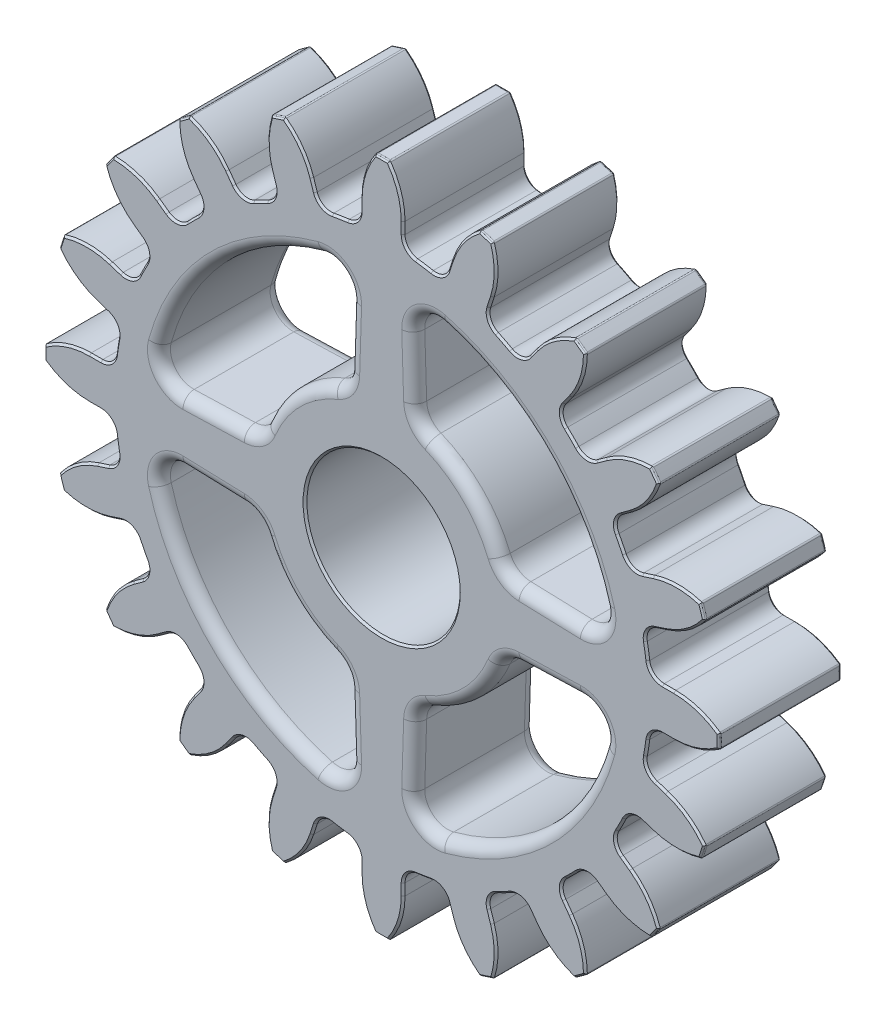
SolidWorks part; units mm, degrees
ref_plane "Спереди" through (0, 0, 0) normal (0, 0, 1) x (1, 0, 0)
ref_plane "Сверху" through (0, 0, 0) normal (0, 1, 0) x (1, 0, 0)
ref_plane "Справа" through (0, 0, 0) normal (1, 0, 0) x (0, 0, -1)
sketch "Эскиз1" plane through (0, 0, 0) normal (0, 0, 1) x (1, 0, 0)
  line L0 (0, 0) -> (0, 44) construction
  line L1 (0, 0) -> (-44, 0) construction
  line L2 (-2.8, 38.1058) -> (-2.8, 36.6039)
  line L3 (2.8, 38.1058) -> (2.8, 36.6039)
  line L4 (9.1124, 37.106) -> (8.6483, 35.6776)
  line L5 (14.4383, 35.3755) -> (13.9742, 33.9471)
  line L6 (20.1328, 32.474) -> (19.25, 31.2589)
  line L7 (24.6632, 29.1824) -> (23.7805, 27.9673)
  line L8 (29.1824, 24.6632) -> (27.9673, 23.7805)
  line L9 (32.474, 20.1328) -> (31.2589, 19.25)
  line L10 (35.3755, 14.4383) -> (33.9471, 13.9742)
  line L11 (37.106, 9.1124) -> (35.6776, 8.6483)
  line L12 (38.1058, 2.8) -> (36.6039, 2.8)
  line L13 (38.1058, -2.8) -> (36.6039, -2.8)
  line L14 (37.106, -9.1124) -> (35.6776, -8.6483)
  line L15 (35.3755, -14.4383) -> (33.9471, -13.9742)
  line L16 (32.474, -20.1328) -> (31.2589, -19.25)
  line L17 (29.1824, -24.6632) -> (27.9673, -23.7805)
  line L18 (24.6632, -29.1824) -> (23.7805, -27.9673)
  line L19 (20.1328, -32.474) -> (19.25, -31.2589)
  line L20 (14.4383, -35.3755) -> (13.9742, -33.9471)
  line L21 (9.1124, -37.106) -> (8.6483, -35.6776)
  line L22 (2.8, -38.1058) -> (2.8, -36.6039)
  line L23 (-2.8, -38.1058) -> (-2.8, -36.6039)
  line L24 (-9.1124, -37.106) -> (-8.6483, -35.6776)
  line L25 (-14.4383, -35.3755) -> (-13.9742, -33.9471)
  line L26 (-20.1328, -32.474) -> (-19.25, -31.2589)
  line L27 (-24.6632, -29.1824) -> (-23.7805, -27.9673)
  line L28 (-29.1824, -24.6632) -> (-27.9673, -23.7805)
  line L29 (-32.474, -20.1328) -> (-31.2589, -19.25)
  line L30 (-35.3755, -14.4383) -> (-33.9471, -13.9742)
  line L31 (-37.106, -9.1124) -> (-35.6776, -8.6483)
  line L32 (-38.1058, -2.8) -> (-36.6039, -2.8)
  line L33 (-38.1058, 2.8) -> (-36.6039, 2.8)
  line L34 (-37.106, 9.1124) -> (-35.6776, 8.6483)
  line L35 (-35.3755, 14.4383) -> (-33.9471, 13.9742)
  line L36 (-32.474, 20.1328) -> (-31.2589, 19.25)
  line L37 (-29.1824, 24.6632) -> (-27.9673, 23.7805)
  line L38 (-24.6632, 29.1824) -> (-23.7805, 27.9673)
  line L39 (-20.1328, 32.474) -> (-19.25, 31.2589)
  line L40 (-14.4383, 35.3755) -> (-13.9742, 33.9471)
  line L41 (-9.1124, 37.106) -> (-8.6483, 35.6776)
  line L42 (-4.1188, 25.9508) -> (-4.37, 17.96)
  line L43 (-25.9508, 4.1188) -> (-17.96, 4.37)
  line L44 (-4, 31.6365) -> (-4, 26.8476) construction
  line L45 (4.1188, 25.9508) -> (4.37, 17.96)
  line L46 (25.9508, 4.1188) -> (17.96, 4.37)
  line L47 (25.9508, -4.1188) -> (17.96, -4.37)
  line L48 (4.1188, -25.9508) -> (4.37, -17.96)
  line L49 (-4.1188, -25.9508) -> (-4.37, -17.96)
  line L50 (-25.9508, -4.1188) -> (-17.96, -4.37)
  circle A0 centre (0, 0) radius 10
  arc A1 (0.8847, 43.9911) -> (-0.8847, 43.9911) centre (0, 0) ccw
  arc A2 (-4.4621, 34.7144) -> (-6.4836, 34.3942) centre (0, 0) ccw
  circle A3 centre (0, 0) radius 38.78 construction
  arc A4 (-0.8847, 43.9911) -> (-2.8, 38.1058) centre (7.2, 38.1058) ccw
  arc A5 (0.8847, 43.9911) -> (2.8, 38.1058) centre (-7.2, 38.1058) cw
  arc A6 (2.8, 36.6039) -> (4.4621, 34.7144) centre (4.705, 36.6039) ccw
  arc A7 (-2.8, 36.6039) -> (-4.4621, 34.7144) centre (-4.705, 36.6039) cw
  arc A8 (8.6483, 35.6776) -> (6.4836, 34.3942) centre (6.8365, 36.2663) cw
  arc A9 (12.7526, 42.1114) -> (9.1124, 37.106) centre (18.6229, 34.0158) ccw
  arc A10 (14.4354, 41.5646) -> (12.7526, 42.1114) centre (0, 0) ccw
  arc A11 (14.4354, 41.5646) -> (14.4383, 35.3755) centre (4.9277, 38.4656) cw
  arc A12 (13.9742, 33.9471) -> (14.9711, 31.6365) centre (15.7859, 33.3584) ccw
  arc A13 (19.25, 31.2589) -> (16.7947, 30.7073) centre (17.7088, 32.3787) cw
  arc A14 (25.1416, 36.1096) -> (20.1328, 32.474) centre (28.2229, 26.5961) ccw
  arc A15 (26.5731, 35.0695) -> (25.1416, 36.1096) centre (0, 0) ccw
  arc A16 (26.5731, 35.0695) -> (24.6632, 29.1824) centre (16.5731, 35.0603) cw
  arc A17 (23.7805, 27.9673) -> (24.0146, 25.4618) centre (25.3216, 26.8476) ccw
  arc A18 (27.9673, 23.7805) -> (25.4618, 24.0146) centre (26.8476, 25.3216) cw
  arc A19 (35.0695, 26.5731) -> (29.1824, 24.6632) centre (35.0603, 16.5731) ccw
  arc A20 (36.1096, 25.1416) -> (35.0695, 26.5731) centre (0, 0) ccw
  arc A21 (36.1096, 25.1416) -> (32.474, 20.1328) centre (26.5961, 28.2229) cw
  arc A22 (31.2589, 19.25) -> (30.7073, 16.7947) centre (32.3787, 17.7088) ccw
  arc A23 (33.9471, 13.9742) -> (31.6365, 14.9711) centre (33.3584, 15.7859) cw
  arc A24 (41.5646, 14.4354) -> (35.3755, 14.4383) centre (38.4656, 4.9277) ccw
  arc A25 (42.1114, 12.7526) -> (41.5646, 14.4354) centre (0, 0) ccw
  arc A26 (42.1114, 12.7526) -> (37.106, 9.1124) centre (34.0158, 18.6229) cw
  arc A27 (35.6776, 8.6483) -> (34.3942, 6.4836) centre (36.2663, 6.8365) ccw
  arc A28 (36.6039, 2.8) -> (34.7144, 4.4621) centre (36.6039, 4.705) cw
  arc A29 (43.9911, 0.8847) -> (38.1058, 2.8) centre (38.1058, -7.2) ccw
  arc A30 (43.9911, -0.8847) -> (43.9911, 0.8847) centre (0, 0) ccw
  arc A31 (43.9911, -0.8847) -> (38.1058, -2.8) centre (38.1058, 7.2) cw
  arc A32 (36.6039, -2.8) -> (34.7144, -4.4621) centre (36.6039, -4.705) ccw
  arc A33 (35.6776, -8.6483) -> (34.3942, -6.4836) centre (36.2663, -6.8365) cw
  arc A34 (42.1114, -12.7526) -> (37.106, -9.1124) centre (34.0158, -18.6229) ccw
  arc A35 (41.5646, -14.4354) -> (42.1114, -12.7526) centre (0, 0) ccw
  arc A36 (41.5646, -14.4354) -> (35.3755, -14.4383) centre (38.4656, -4.9277) cw
  arc A37 (33.9471, -13.9742) -> (31.6365, -14.9711) centre (33.3584, -15.7859) ccw
  arc A38 (31.2589, -19.25) -> (30.7073, -16.7947) centre (32.3787, -17.7088) cw
  arc A39 (36.1096, -25.1416) -> (32.474, -20.1328) centre (26.5961, -28.2229) ccw
  arc A40 (35.0695, -26.5731) -> (36.1096, -25.1416) centre (0, 0) ccw
  arc A41 (35.0695, -26.5731) -> (29.1824, -24.6632) centre (35.0603, -16.5731) cw
  arc A42 (27.9673, -23.7805) -> (25.4618, -24.0146) centre (26.8476, -25.3216) ccw
  arc A43 (23.7805, -27.9673) -> (24.0146, -25.4618) centre (25.3216, -26.8476) cw
  arc A44 (26.5731, -35.0695) -> (24.6632, -29.1824) centre (16.5731, -35.0603) ccw
  arc A45 (25.1416, -36.1096) -> (26.5731, -35.0695) centre (0, 0) ccw
  arc A46 (25.1416, -36.1096) -> (20.1328, -32.474) centre (28.2229, -26.5961) cw
  arc A47 (19.25, -31.2589) -> (16.7947, -30.7073) centre (17.7088, -32.3787) ccw
  arc A48 (13.9742, -33.9471) -> (14.9711, -31.6365) centre (15.7859, -33.3584) cw
  arc A49 (14.4354, -41.5646) -> (14.4383, -35.3755) centre (4.9277, -38.4656) ccw
  arc A50 (12.7526, -42.1114) -> (14.4354, -41.5646) centre (0, 0) ccw
  arc A51 (12.7526, -42.1114) -> (9.1124, -37.106) centre (18.6229, -34.0158) cw
  arc A52 (8.6483, -35.6776) -> (6.4836, -34.3942) centre (6.8365, -36.2663) ccw
  arc A53 (2.8, -36.6039) -> (4.4621, -34.7144) centre (4.705, -36.6039) cw
  arc A54 (0.8847, -43.9911) -> (2.8, -38.1058) centre (-7.2, -38.1058) ccw
  arc A55 (-0.8847, -43.9911) -> (0.8847, -43.9911) centre (0, 0) ccw
  arc A56 (-0.8847, -43.9911) -> (-2.8, -38.1058) centre (7.2, -38.1058) cw
  arc A57 (-2.8, -36.6039) -> (-4.4621, -34.7144) centre (-4.705, -36.6039) ccw
  arc A58 (-8.6483, -35.6776) -> (-6.4836, -34.3942) centre (-6.8365, -36.2663) cw
  arc A59 (-12.7526, -42.1114) -> (-9.1124, -37.106) centre (-18.6229, -34.0158) ccw
  arc A60 (-14.4354, -41.5646) -> (-12.7526, -42.1114) centre (0, 0) ccw
  arc A61 (-14.4354, -41.5646) -> (-14.4383, -35.3755) centre (-4.9277, -38.4656) cw
  arc A62 (-13.9742, -33.9471) -> (-14.9711, -31.6365) centre (-15.7859, -33.3584) ccw
  arc A63 (-19.25, -31.2589) -> (-16.7947, -30.7073) centre (-17.7088, -32.3787) cw
  arc A64 (-25.1416, -36.1096) -> (-20.1328, -32.474) centre (-28.2229, -26.5961) ccw
  arc A65 (-26.5731, -35.0695) -> (-25.1416, -36.1096) centre (0, 0) ccw
  arc A66 (-26.5731, -35.0695) -> (-24.6632, -29.1824) centre (-16.5731, -35.0603) cw
  arc A67 (-23.7805, -27.9673) -> (-24.0146, -25.4618) centre (-25.3216, -26.8476) ccw
  arc A68 (-27.9673, -23.7805) -> (-25.4618, -24.0146) centre (-26.8476, -25.3216) cw
  arc A69 (-35.0695, -26.5731) -> (-29.1824, -24.6632) centre (-35.0603, -16.5731) ccw
  arc A70 (-36.1096, -25.1416) -> (-35.0695, -26.5731) centre (0, 0) ccw
  arc A71 (-36.1096, -25.1416) -> (-32.474, -20.1328) centre (-26.5961, -28.2229) cw
  arc A72 (-31.2589, -19.25) -> (-30.7073, -16.7947) centre (-32.3787, -17.7088) ccw
  arc A73 (-33.9471, -13.9742) -> (-31.6365, -14.9711) centre (-33.3584, -15.7859) cw
  arc A74 (-41.5646, -14.4354) -> (-35.3755, -14.4383) centre (-38.4656, -4.9277) ccw
  arc A75 (-42.1114, -12.7526) -> (-41.5646, -14.4354) centre (0, 0) ccw
  arc A76 (-42.1114, -12.7526) -> (-37.106, -9.1124) centre (-34.0158, -18.6229) cw
  arc A77 (-35.6776, -8.6483) -> (-34.3942, -6.4836) centre (-36.2663, -6.8365) ccw
  arc A78 (-36.6039, -2.8) -> (-34.7144, -4.4621) centre (-36.6039, -4.705) cw
  arc A79 (-43.9911, -0.8847) -> (-38.1058, -2.8) centre (-38.1058, 7.2) ccw
  arc A80 (-43.9911, 0.8847) -> (-43.9911, -0.8847) centre (0, 0) ccw
  arc A81 (-43.9911, 0.8847) -> (-38.1058, 2.8) centre (-38.1058, -7.2) cw
  arc A82 (-36.6039, 2.8) -> (-34.7144, 4.4621) centre (-36.6039, 4.705) ccw
  arc A83 (-35.6776, 8.6483) -> (-34.3942, 6.4836) centre (-36.2663, 6.8365) cw
  arc A84 (-42.1114, 12.7526) -> (-37.106, 9.1124) centre (-34.0158, 18.6229) ccw
  arc A85 (-41.5646, 14.4354) -> (-42.1114, 12.7526) centre (0, 0) ccw
  arc A86 (-41.5646, 14.4354) -> (-35.3755, 14.4383) centre (-38.4656, 4.9277) cw
  arc A87 (-33.9471, 13.9742) -> (-31.6365, 14.9711) centre (-33.3584, 15.7859) ccw
  arc A88 (-31.2589, 19.25) -> (-30.7073, 16.7947) centre (-32.3787, 17.7088) cw
  arc A89 (-36.1096, 25.1416) -> (-32.474, 20.1328) centre (-26.5961, 28.2229) ccw
  arc A90 (-35.0695, 26.5731) -> (-36.1096, 25.1416) centre (0, 0) ccw
  arc A91 (-35.0695, 26.5731) -> (-29.1824, 24.6632) centre (-35.0603, 16.5731) cw
  arc A92 (-27.9673, 23.7805) -> (-25.4618, 24.0146) centre (-26.8476, 25.3216) ccw
  arc A93 (-23.7805, 27.9673) -> (-24.0146, 25.4618) centre (-25.3216, 26.8476) cw
  arc A94 (-26.5731, 35.0695) -> (-24.6632, 29.1824) centre (-16.5731, 35.0603) ccw
  arc A95 (-25.1416, 36.1096) -> (-26.5731, 35.0695) centre (0, 0) ccw
  arc A96 (-25.1416, 36.1096) -> (-20.1328, 32.474) centre (-28.2229, 26.5961) cw
  arc A97 (-19.25, 31.2589) -> (-16.7947, 30.7073) centre (-17.7088, 32.3787) ccw
  arc A98 (-13.9742, 33.9471) -> (-14.9711, 31.6365) centre (-15.7859, 33.3584) cw
  arc A99 (-14.4354, 41.5646) -> (-14.4383, 35.3755) centre (-4.9277, 38.4656) ccw
  arc A100 (-12.7526, 42.1114) -> (-14.4354, 41.5646) centre (0, 0) ccw
  arc A101 (-12.7526, 42.1114) -> (-9.1124, 37.106) centre (-18.6229, 34.0158) cw
  arc A102 (-8.6483, 35.6776) -> (-6.4836, 34.3942) centre (-6.8365, 36.2663) ccw
  arc A103 (-14.9711, 31.6365) -> (-16.7947, 30.7073) centre (0, 0) ccw
  arc A104 (6.4836, 34.3942) -> (4.4621, 34.7144) centre (0, 0) ccw
  arc A105 (16.7947, 30.7073) -> (14.9711, 31.6365) centre (0, 0) ccw
  arc A106 (25.4618, 24.0146) -> (24.0146, 25.4618) centre (0, 0) ccw
  arc A107 (-24.0146, 25.4618) -> (-25.4618, 24.0146) centre (0, 0) ccw
  arc A108 (-30.7073, 16.7947) -> (-31.6365, 14.9711) centre (0, 0) ccw
  arc A109 (-34.3942, 6.4836) -> (-34.7144, 4.4621) centre (0, 0) ccw
  arc A110 (31.6365, 14.9711) -> (30.7073, 16.7947) centre (0, 0) ccw
  arc A111 (-34.7144, -4.4621) -> (-34.3942, -6.4836) centre (0, 0) ccw
  arc A112 (-31.6365, -14.9711) -> (-30.7073, -16.7947) centre (0, 0) ccw
  arc A113 (-25.4618, -24.0146) -> (-24.0146, -25.4618) centre (0, 0) ccw
  arc A114 (-16.7947, -30.7073) -> (-14.9711, -31.6365) centre (0, 0) ccw
  arc A115 (-6.4836, -34.3942) -> (-4.4621, -34.7144) centre (0, 0) ccw
  arc A116 (4.4621, -34.7144) -> (6.4836, -34.3942) centre (0, 0) ccw
  arc A117 (14.9711, -31.6365) -> (16.7947, -30.7073) centre (0, 0) ccw
  arc A118 (24.0146, -25.4618) -> (25.4618, -24.0146) centre (0, 0) ccw
  arc A119 (30.7073, -16.7947) -> (31.6365, -14.9711) centre (0, 0) ccw
  arc A120 (34.3942, -6.4836) -> (34.7144, -4.4621) centre (0, 0) ccw
  arc A121 (34.7144, 4.4621) -> (34.3942, 6.4836) centre (0, 0) ccw
  arc A122 (-6.2349, 15.2767) -> (-15.2767, 6.2349) centre (0, 0) ccw
  arc A123 (-7.9082, 28.9389) -> (-28.9389, 7.9082) centre (0, 0) ccw
  arc A124 (-4.1188, 25.9508) -> (-7.9082, 28.9389) centre (-7.1174, 26.045) ccw
  arc A125 (-4.37, 17.96) -> (-6.2349, 15.2767) centre (-7.3685, 18.0542) cw
  arc A126 (-17.96, 4.37) -> (-15.2767, 6.2349) centre (-18.0542, 7.3685) ccw
  arc A127 (-25.9508, 4.1188) -> (-28.9389, 7.9082) centre (-26.045, 7.1174) cw
  arc A128 (15.2767, 6.2349) -> (6.2349, 15.2767) centre (0, 0) ccw
  arc A129 (17.96, 4.37) -> (15.2767, 6.2349) centre (18.0542, 7.3685) cw
  arc A130 (4.37, 17.96) -> (6.2349, 15.2767) centre (7.3685, 18.0542) ccw
  arc A131 (25.9508, 4.1188) -> (28.9389, 7.9082) centre (26.045, 7.1174) ccw
  arc A132 (4.1188, 25.9508) -> (7.9082, 28.9389) centre (7.1174, 26.045) cw
  arc A133 (28.9389, 7.9082) -> (7.9082, 28.9389) centre (0, 0) ccw
  arc A134 (6.2349, -15.2767) -> (15.2767, -6.2349) centre (0, 0) ccw
  arc A135 (4.37, -17.96) -> (6.2349, -15.2767) centre (7.3685, -18.0542) cw
  arc A136 (17.96, -4.37) -> (15.2767, -6.2349) centre (18.0542, -7.3685) ccw
  arc A137 (4.1188, -25.9508) -> (7.9082, -28.9389) centre (7.1174, -26.045) ccw
  arc A138 (25.9508, -4.1188) -> (28.9389, -7.9082) centre (26.045, -7.1174) cw
  arc A139 (7.9082, -28.9389) -> (28.9389, -7.9082) centre (0, 0) ccw
  arc A140 (-15.2767, -6.2349) -> (-6.2349, -15.2767) centre (0, 0) ccw
  arc A141 (-17.96, -4.37) -> (-15.2767, -6.2349) centre (-18.0542, -7.3685) cw
  arc A142 (-4.37, -17.96) -> (-6.2349, -15.2767) centre (-7.3685, -18.0542) ccw
  arc A143 (-25.9508, -4.1188) -> (-28.9389, -7.9082) centre (-26.045, -7.1174) ccw
  arc A144 (-4.1188, -25.9508) -> (-7.9082, -28.9389) centre (-7.1174, -26.045) cw
  arc A145 (-28.9389, -7.9082) -> (-7.9082, -28.9389) centre (0, 0) ccw
  point P16 (2.8, 34.8878)
  point P19 (-2.8, 34.8878)
  point P275 (-4, 29.7321)
  dimension "D1" = 20
  dimension "D2" = 88
  dimension "D3" = 70
  dimension "D4" = 77.56
  dimension "D6" = 20
  dimension "D7" = 1.905
  dimension "D9" = 33
  dimension "D10" = 60
  dimension "D14" = 3
  dimension "D5" = 5.6
  dimension "D11" = 1.8
  dimension "D12" = 1.8
  dimension "D13" = 4
  dimension "D8" = 20
  dimension "D15" = 4
extrude "Бобышка-Вытянуть1" add sketch "Эскиз1" along normal blind 16
fillet "Скругление1" radius 1.5 64 edges at (4.2444, -21.9554, 16) (4.905, -16.3421, 16) (11.6673, -11.6673, 16) (16.3421, -4.905, 16) (21.9554, -4.2444, 16) (28.4007, -5.2597, 16) (21.2132, -21.2132, 16) (4.2444, -21.9554, 0) (4.905, -16.3421, 0) (11.6673, -11.6673, 0) (16.3421, -4.905, 0) (21.9554, -4.2444, 0) (28.4007, -5.2597, 0) (21.2132, -21.2132, 0) (-28.4007, -5.2597, 16) (-21.9554, -4.2444, 16) (-16.3421, -4.905, 16) (-11.6673, -11.6673, 16) (-4.905, -16.3421, 16) (-4.2444, -21.9554, 16) (-5.2597, -28.4007, 16) (-28.4007, -5.2597, 0) (-21.9554, -4.2444, 0) (-16.3421, -4.905, 0) (-11.6673, -11.6673, 0) (-4.905, -16.3421, 0) (-4.2444, -21.9554, 0) (-5.2597, -28.4007, 0) (-28.4007, 5.2597, 16) (-21.2132, 21.2132, 16) (-5.2597, 28.4007, 16) (-4.2444, 21.9554, 16) (-4.905, 16.3421, 16) (-11.6673, 11.6673, 16) (-16.3421, 4.905, 16) (-28.4007, 5.2597, 0) (-21.2132, 21.2132, 0) (-5.2597, 28.4007, 0) (-4.2444, 21.9554, 0) (-4.905, 16.3421, 0) (-11.6673, 11.6673, 0) (-16.3421, 4.905, 0) (4.905, 16.3421, 16) (4.2444, 21.9554, 16) (5.2597, 28.4007, 16) (21.2132, 21.2132, 16) (28.4007, 5.2597, 16) (21.9554, 4.2444, 16) (16.3421, 4.905, 16) (4.905, 16.3421, 0) (4.2444, 21.9554, 0) (5.2597, 28.4007, 0) (21.2132, 21.2132, 0) (28.4007, 5.2597, 0) (21.9554, 4.2444, 0) (16.3421, 4.905, 0) (5.2597, -28.4007, 16) (5.2597, -28.4007, 0) (-21.2132, -21.2132, 16) (-21.2132, -21.2132, 0) (-21.9554, 4.2444, 16) (-21.9554, 4.2444, 0) (11.6673, 11.6673, 16) (11.6673, 11.6673, 0)
chamfer "Фаска1" distance 0.25 angle 45 322 edges at (10, 0, 0) (2.8, 37.3548, 0) (2.3091, 41.2003, 0) (0, 44, 0) (-2.3091, 41.2003, 0) (-2.8, 37.3548, 0) (-3.2747, 35.3456, 0) (-5.4752, 34.5691, 0) (-7.808, 34.6276, 0) (-8.8803, 36.3918, 0) (-10.5355, 39.8974, 0) (-13.5967, 41.8465, 0) (-14.9277, 38.4703, 0) (-14.2062, 34.6613, 0) (-14.0368, 32.6037, 0) (-15.8897, 31.1852, 0) (-18.1264, 30.52, 0) (-19.6914, 31.8665, 0) (-22.3488, 34.689, 0) (-25.8626, 35.5967, 0) (-26.0851, 31.9745, 0) (-24.2218, 28.5749, 0) (-23.4249, 26.6704, 0) (-24.7487, 24.7487, 0) (-26.6704, 23.4249, 0) (-28.5749, 24.2218, 0) (-31.9745, 26.0851, 0) (-35.5967, 25.8626, 0) (-34.689, 22.3488, 0) (-31.8665, 19.6914, 0) (-30.52, 18.1264, 0) (-31.1852, 15.8897, 0) (-32.6037, 14.0368, 0) (-34.6613, 14.2062, 0) (-38.4703, 14.9277, 0) (-41.8465, 13.5967, 0) (-39.8974, 10.5355, 0) (-36.3918, 8.8803, 0) (-34.6276, 7.808, 0) (-34.5691, 5.4752, 0) (-35.3456, 3.2747, 0) (-37.3548, 2.8, 0) (-41.2003, 2.3091, 0) (-44, 0, 0) (-41.2003, -2.3091, 0) (-37.3548, -2.8, 0) (-35.3456, -3.2747, 0) (-34.5691, -5.4752, 0) (-34.6276, -7.808, 0) (-36.3918, -8.8803, 0) (-39.8974, -10.5355, 0) (-41.8465, -13.5967, 0) (-38.4703, -14.9277, 0) (-34.6613, -14.2062, 0) (-32.6037, -14.0368, 0) (-31.1852, -15.8897, 0) (-30.52, -18.1264, 0) (-31.8665, -19.6914, 0) (-34.689, -22.3488, 0) (-35.5967, -25.8626, 0) (-31.9745, -26.0851, 0) (-28.5749, -24.2218, 0) (-26.6704, -23.4249, 0) (-24.7487, -24.7487, 0) (-23.4249, -26.6704, 0) (-24.2218, -28.5749, 0) (-26.0851, -31.9745, 0) (-25.8626, -35.5967, 0) (-22.3488, -34.689, 0) (-19.6914, -31.8665, 0) (-18.1264, -30.52, 0) (-15.8897, -31.1852, 0) (-14.0368, -32.6037, 0) (-14.2062, -34.6613, 0) (-14.9277, -38.4703, 0) (-13.5967, -41.8465, 0) (-10.5355, -39.8974, 0) (-8.8803, -36.3918, 0) (-7.808, -34.6276, 0) (-5.4752, -34.5691, 0) (-3.2747, -35.3456, 0) (-2.8, -37.3548, 0) (-2.3091, -41.2003, 0) (0, -44, 0) (2.3091, -41.2003, 0) (2.8, -37.3548, 0) (3.2747, -35.3456, 0) (5.4752, -34.5691, 0) (7.808, -34.6276, 0) (8.8803, -36.3918, 0) (10.5355, -39.8974, 0) (13.5967, -41.8465, 0) (14.9277, -38.4703, 0) (14.2062, -34.6613, 0) (14.0368, -32.6037, 0) (15.8897, -31.1852, 0) (18.1264, -30.52, 0) (19.6914, -31.8665, 0) (22.3488, -34.689, 0) (25.8626, -35.5967, 0) (26.0851, -31.9745, 0) (24.2218, -28.5749, 0) (23.4249, -26.6704, 0) (24.7487, -24.7487, 0) (26.6704, -23.4249, 0) (28.5749, -24.2218, 0) (31.9745, -26.0851, 0) (35.5967, -25.8626, 0) (34.689, -22.3488, 0) (31.8665, -19.6914, 0) (30.52, -18.1264, 0) (31.1852, -15.8897, 0) (32.6037, -14.0368, 0) (34.6613, -14.2062, 0) (38.4703, -14.9277, 0) (41.8465, -13.5967, 0) (39.8974, -10.5355, 0) (36.3918, -8.8803, 0) (34.6276, -7.808, 0) (34.5691, -5.4752, 0) (35.3456, -3.2747, 0) (37.3548, -2.8, 0) (41.2003, -2.3091, 0) (44, 0, 0) (41.2003, 2.3091, 0) (37.3548, 2.8, 0) (35.3456, 3.2747, 0) (34.5691, 5.4752, 0) (34.6276, 7.808, 0) (36.3918, 8.8803, 0) (39.8974, 10.5355, 0) (41.8465, 13.5967, 0) (38.4703, 14.9277, 0) (34.6613, 14.2062, 0) (32.6037, 14.0368, 0) (31.1852, 15.8897, 0) (30.52, 18.1264, 0) (31.8665, 19.6914, 0) (34.689, 22.3488, 0) (35.5967, 25.8626, 0) (31.9745, 26.0851, 0) (28.5749, 24.2218, 0) (26.6704, 23.4249, 0) (24.7487, 24.7487, 0) (23.4249, 26.6704, 0) (24.2218, 28.5749, 0) (26.0851, 31.9745, 0) (25.8626, 35.5967, 0) (22.3488, 34.689, 0) (19.6914, 31.8665, 0) (18.1264, 30.52, 0) (15.8897, 31.1852, 0) (14.0368, 32.6037, 0) (14.2062, 34.6613, 0) (14.9277, 38.4703, 0) (13.5967, 41.8465, 0) (10.5355, 39.8974, 0) (8.8803, 36.3918, 0) (7.808, 34.6276, 0) (5.4752, 34.5691, 0) (3.2747, 35.3456, 0) (10, 0, 16) (5.4752, 34.5691, 16) (7.808, 34.6276, 16) (8.8803, 36.3918, 16) (10.5355, 39.8974, 16) (13.5967, 41.8465, 16) (14.9277, 38.4703, 16) (14.2062, 34.6613, 16) (14.0368, 32.6037, 16) (15.8897, 31.1852, 16) (18.1264, 30.52, 16) (19.6914, 31.8665, 16) (22.3488, 34.689, 16) (25.8626, 35.5967, 16) (26.0851, 31.9745, 16) (24.2218, 28.5749, 16) (23.4249, 26.6704, 16) (24.7487, 24.7487, 16) (26.6704, 23.4249, 16) (28.5749, 24.2218, 16) (31.9745, 26.0851, 16) (35.5967, 25.8626, 16) (34.689, 22.3488, 16) (31.8665, 19.6914, 16) (30.52, 18.1264, 16) (31.1852, 15.8897, 16) (32.6037, 14.0368, 16) (34.6613, 14.2062, 16) (38.4703, 14.9277, 16) (41.8465, 13.5967, 16) (39.8974, 10.5355, 16) (36.3918, 8.8803, 16) (34.6276, 7.808, 16) (34.5691, 5.4752, 16) (35.3456, 3.2747, 16) (37.3548, 2.8, 16) (41.2003, 2.3091, 16) (44, 0, 16) (41.2003, -2.3091, 16) (37.3548, -2.8, 16) (35.3456, -3.2747, 16) (34.5691, -5.4752, 16) (34.6276, -7.808, 16) (36.3918, -8.8803, 16) (39.8974, -10.5355, 16) (41.8465, -13.5967, 16) (38.4703, -14.9277, 16) (34.6613, -14.2062, 16) (32.6037, -14.0368, 16) (31.1852, -15.8897, 16) (30.52, -18.1264, 16) (31.8665, -19.6914, 16) (34.689, -22.3488, 16) (35.5967, -25.8626, 16) (31.9745, -26.0851, 16) (28.5749, -24.2218, 16) (26.6704, -23.4249, 16) (24.7487, -24.7487, 16) (23.4249, -26.6704, 16) (24.2218, -28.5749, 16) (26.0851, -31.9745, 16) (25.8626, -35.5967, 16) (22.3488, -34.689, 16) (19.6914, -31.8665, 16) (18.1264, -30.52, 16) (15.8897, -31.1852, 16) (14.0368, -32.6037, 16) (14.2062, -34.6613, 16) (14.9277, -38.4703, 16) (13.5967, -41.8465, 16) (10.5355, -39.8974, 16) (8.8803, -36.3918, 16) (7.808, -34.6276, 16) (5.4752, -34.5691, 16) (3.2747, -35.3456, 16) (2.8, -37.3548, 16) (2.3091, -41.2003, 16) (0, -44, 16) (-2.3091, -41.2003, 16) (-2.8, -37.3548, 16) (-3.2747, -35.3456, 16) (-5.4752, -34.5691, 16) (-7.808, -34.6276, 16) (-8.8803, -36.3918, 16) (-10.5355, -39.8974, 16) (-13.5967, -41.8465, 16) (-14.9277, -38.4703, 16) (-14.2062, -34.6613, 16) (-14.0368, -32.6037, 16) (-15.8897, -31.1852, 16) (-18.1264, -30.52, 16) (-19.6914, -31.8665, 16) (-22.3488, -34.689, 16) (-25.8626, -35.5967, 16) (-26.0851, -31.9745, 16) (-24.2218, -28.5749, 16) (-23.4249, -26.6704, 16) (-24.7487, -24.7487, 16) (-26.6704, -23.4249, 16) (-28.5749, -24.2218, 16) (-31.9745, -26.0851, 16) (-35.5967, -25.8626, 16) (-34.689, -22.3488, 16) (-31.8665, -19.6914, 16) (-30.52, -18.1264, 16) (-31.1852, -15.8897, 16) (-32.6037, -14.0368, 16) (-34.6613, -14.2062, 16) (-38.4703, -14.9277, 16) (-41.8465, -13.5967, 16) (-39.8974, -10.5355, 16) (-36.3918, -8.8803, 16) (-34.6276, -7.808, 16) (-34.5691, -5.4752, 16) (-35.3456, -3.2747, 16) (-37.3548, -2.8, 16) (-41.2003, -2.3091, 16) (-44, 0, 16) (-41.2003, 2.3091, 16) (-37.3548, 2.8, 16) (-35.3456, 3.2747, 16) (-34.5691, 5.4752, 16) (-34.6276, 7.808, 16) (-36.3918, 8.8803, 16) (-39.8974, 10.5355, 16) (-41.8465, 13.5967, 16) (-38.4703, 14.9277, 16) (-34.6613, 14.2062, 16) (-32.6037, 14.0368, 16) (-31.1852, 15.8897, 16) (-30.52, 18.1264, 16) (-31.8665, 19.6914, 16) (-34.689, 22.3488, 16) (-35.5967, 25.8626, 16) (-31.9745, 26.0851, 16) (-28.5749, 24.2218, 16) (-26.6704, 23.4249, 16) (-24.7487, 24.7487, 16) (-23.4249, 26.6704, 16) (-24.2218, 28.5749, 16) (-26.0851, 31.9745, 16) (-25.8626, 35.5967, 16) (-22.3488, 34.689, 16) (-19.6914, 31.8665, 16) (-18.1264, 30.52, 16) (-15.8897, 31.1852, 16) (-14.0368, 32.6037, 16) (-14.2062, 34.6613, 16) (-14.9277, 38.4703, 16) (-13.5967, 41.8465, 16) (-10.5355, 39.8974, 16) (-8.8803, 36.3918, 16) (-7.808, 34.6276, 16) (-5.4752, 34.5691, 16) (-3.2747, 35.3456, 16) (-2.8, 37.3548, 16) (-2.3091, 41.2003, 16) (0, 44, 16) (2.3091, 41.2003, 16) (2.8, 37.3548, 16) (3.2747, 35.3456, 16)
fillet "Скругление2" radius 0.25 80 edges at (25.8626, -35.5967, 15.75) (26.5731, -35.0695, 8) (25.8626, -35.5967, 0.25) (25.1416, -36.1096, 8) (13.5967, -41.8465, 15.75) (14.4354, -41.5646, 8) (13.5967, -41.8465, 0.25) (12.7526, -42.1114, 8) (0, -44, 15.75) (0.8847, -43.9911, 8) (0, -44, 0.25) (-0.8847, -43.9911, 8) (-13.5967, -41.8465, 15.75) (-12.7526, -42.1114, 8) (-13.5967, -41.8465, 0.25) (-14.4354, -41.5646, 8) (-25.8626, -35.5967, 15.75) (-25.1416, -36.1096, 8) (-25.8626, -35.5967, 0.25) (-26.5731, -35.0695, 8) (-35.5967, -25.8626, 15.75) (-35.0695, -26.5731, 8) (-35.5967, -25.8626, 0.25) (-36.1096, -25.1416, 8) (-41.8465, -13.5967, 15.75) (-41.5646, -14.4354, 8) (-41.8465, -13.5967, 0.25) (-42.1114, -12.7526, 8) (-44, 0, 15.75) (-43.9911, -0.8847, 8) (-44, 0, 0.25) (-43.9911, 0.8847, 8) (-41.8465, 13.5967, 15.75) (-42.1114, 12.7526, 8) (-41.8465, 13.5967, 0.25) (-41.5646, 14.4354, 8) (-35.5967, 25.8626, 15.75) (-36.1096, 25.1416, 8) (-35.5967, 25.8626, 0.25) (-35.0695, 26.5731, 8) (35.5967, -25.8626, 15.75) (36.1096, -25.1416, 8) (35.5967, -25.8626, 0.25) (35.0695, -26.5731, 8) (41.8465, -13.5967, 15.75) (42.1114, -12.7526, 8) (41.8465, -13.5967, 0.25) (41.5646, -14.4354, 8) (44, 0, 15.75) (43.9911, 0.8847, 8) (44, 0, 0.25) (43.9911, -0.8847, 8) (41.8465, 13.5967, 15.75) (41.5646, 14.4354, 8) (41.8465, 13.5967, 0.25) (42.1114, 12.7526, 8) (35.5967, 25.8626, 15.75) (35.0695, 26.5731, 8) (35.5967, 25.8626, 0.25) (36.1096, 25.1416, 8) (25.8626, 35.5967, 15.75) (25.1416, 36.1096, 8) (25.8626, 35.5967, 0.25) (26.5731, 35.0695, 8) (13.5967, 41.8465, 15.75) (12.7526, 42.1114, 8) (13.5967, 41.8465, 0.25) (14.4354, 41.5646, 8) (0, 44, 15.75) (-0.8847, 43.9911, 8) (0, 44, 0.25) (0.8847, 43.9911, 8) (-25.8626, 35.5967, 15.75) (-26.5731, 35.0695, 8) (-25.8626, 35.5967, 0.25) (-25.1416, 36.1096, 8) (-13.5967, 41.8465, 15.75) (-14.4354, 41.5646, 8) (-13.5967, 41.8465, 0.25) (-12.7526, 42.1114, 8)
